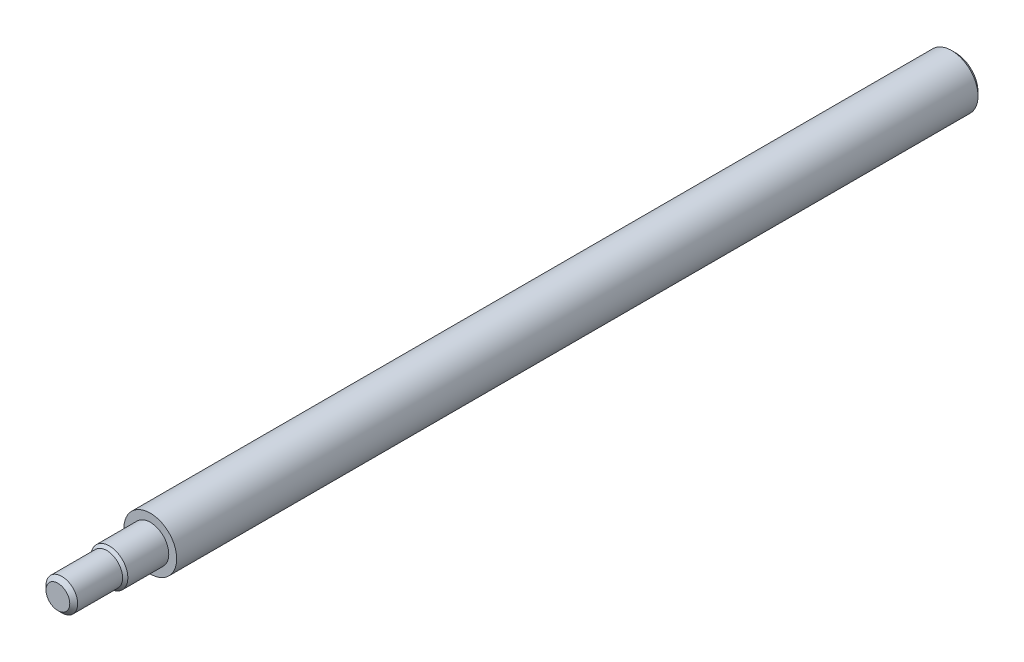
SolidWorks part; units mm, degrees
ref_plane "前视基准面" through (0, 0, 0) normal (0, 0, 1) x (1, 0, 0)
ref_plane "上视基准面" through (0, 0, 0) normal (0, 1, 0) x (1, 0, 0)
ref_plane "右视基准面" through (0, 0, 0) normal (1, 0, 0) x (0, 0, -1)
sketch "草图1" plane through (0, 0, 0) normal (0, 0, 1) x (1, 0, 0)
  circle A0 centre (0, 0) radius 10
extrude "凸台-拉伸1" add sketch "草图1" along normal blind 305
sketch "草图2" plane through (0, 0, 305) normal (0, 0, 1) x (1, 0, 0)
  circle A0 centre (0, 0) radius 7
extrude "凸台-拉伸2" add sketch "草图2" along normal blind 17
sketch "草图3" plane through (0, 0, 322) normal (0, 0, 1) x (1, 0, 0)
  circle A0 centre (0, 0) radius 6
extrude "凸台-拉伸3" add sketch "草图3" along normal blind 18
chamfer "倒角1" distance 1.5 angle 45 3 edges at (10, 0, 0) (7, 0, 322) (6, 0, 340)
